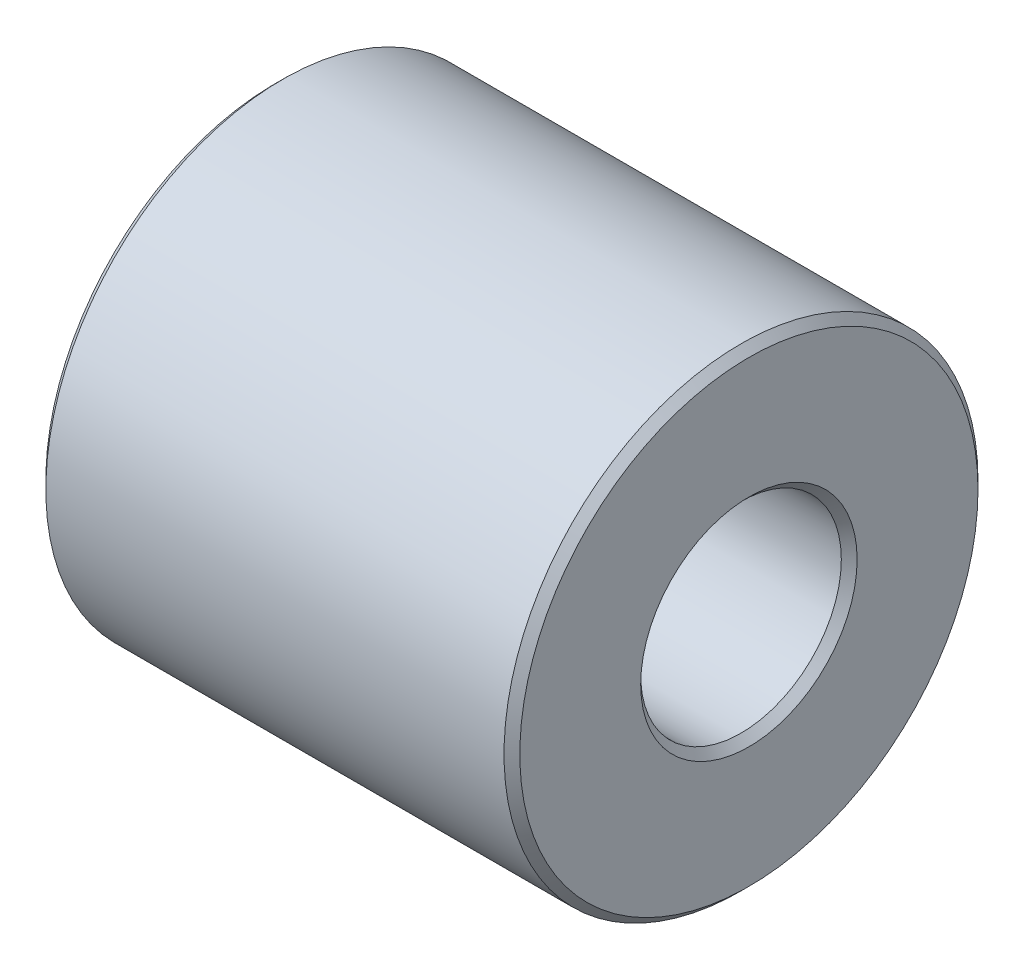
SolidWorks part; units mm, degrees
ref_plane "Спереди" through (0, 0, 0) normal (0, 0, 1) x (1, 0, 0)
ref_plane "Сверху" through (0, 0, 0) normal (0, 1, 0) x (1, 0, 0)
ref_plane "Справа" through (0, 0, 0) normal (1, 0, 0) x (0, 0, -1)
sketch "Эскиз1" plane through (0, 0, 0) normal (1, 0, 0) x (0, 0, -1)
  circle A0 centre (0, 0) radius 6.35
  circle A1 centre (0, 0) radius 15
  dimension "D1" = 30
  dimension "D2" = 12.7
extrude "Бобышка-Вытянуть1" add sketch "Эскиз1" along normal blind 30
chamfer "Фаска1" distance 0.5 angle 45 4 edges at (0, 0, -15) (30, 0, -15) (0, 0, -6.35) (30, 0, -6.35)
